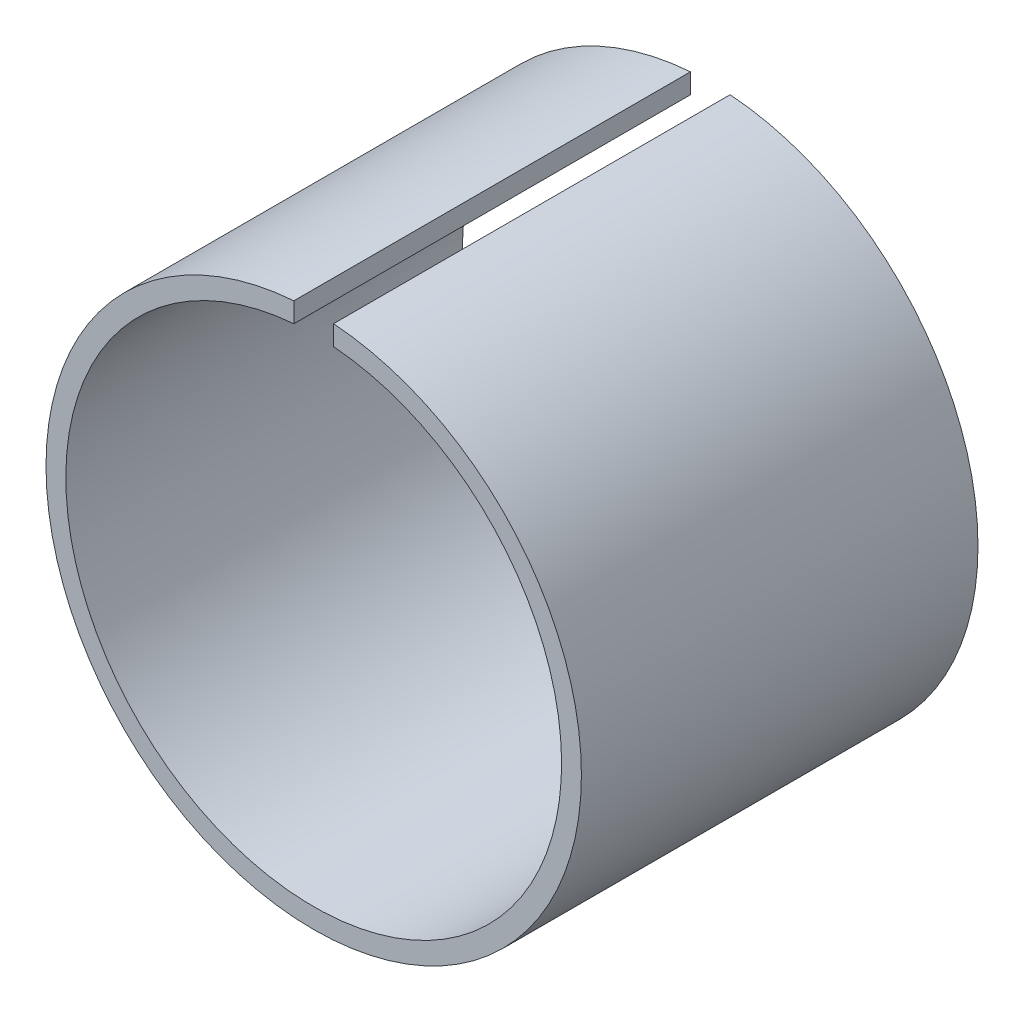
SolidWorks part; units mm, degrees
ref_plane "Plan de face" through (0, 0, 0) normal (0, 0, 1) x (1, 0, 0)
ref_plane "Plan de dessus" through (0, 0, 0) normal (0, 1, 0) x (1, 0, 0)
ref_plane "Plan de droite" through (0, 0, 0) normal (1, 0, 0) x (0, 0, -1)
sketch "Esquisse1" plane through (0, 0, 0) normal (0, 0, 1) x (1, 0, 0)
  line L0 (0, 0) -> (0, 13.5) construction
  line L1 (1, 13.4629) -> (1, 12.4599)
  line L3 (-1, 13.4629) -> (-1, 12.4599)
  arc A0 (-1, 13.4629) -> (1, 13.4629) centre (0, 0) ccw
  arc A1 (-1, 12.4599) -> (1, 12.4599) centre (0, 0) ccw
  dimension "D1" = 25
  dimension "D2" = 27
  dimension "D3" = 2
extrude "Extrusion1" add sketch "Esquisse1" along normal blind 20
